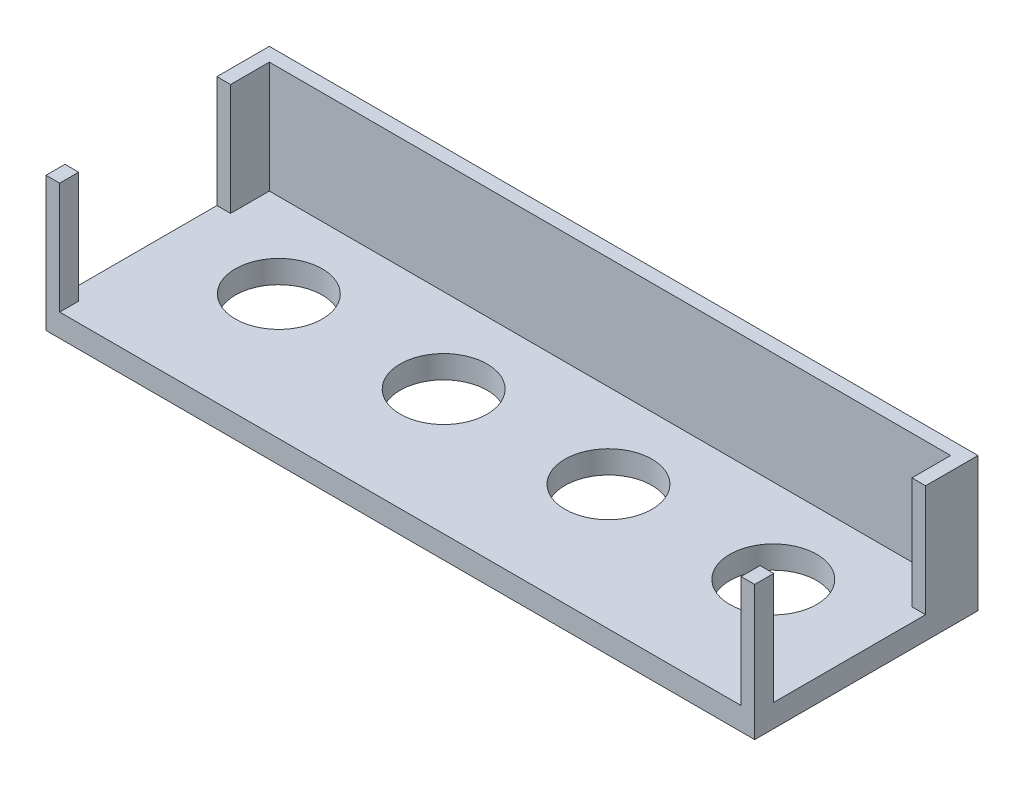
SolidWorks part; units mm, degrees
ref_plane "Alzado" through (0, 0, 0) normal (0, 0, 1) x (1, 0, 0)
ref_plane "Planta" through (0, 0, 0) normal (0, 1, 0) x (1, 0, 0)
ref_plane "Vista lateral" through (0, 0, 0) normal (1, 0, 0) x (0, 0, -1)
sketch "Croquis1" plane through (0, 0, 0) normal (0, 1, 0) x (1, 0, 0)
  line L1 (0, 0) -> (89.3, 0)
  line L2 (0, 0) -> (0, 54.8)
  line L3 (0, 54.8) -> (89.3, 54.8)
  line L4 (89.3, 0) -> (89.3, 54.8)
  circle A0 centre (12.15, 43.9) radius 5.725
  circle A1 centre (33.85, 43.9) radius 5.725
  circle A2 centre (55.55, 43.9) radius 5.725
  circle A3 centre (77.25, 43.9) radius 5.725
  dimension "D3" = 11.45
  dimension "D1" = 89.3
  dimension "D2" = 54.8
  dimension "D4" = 10.9
  dimension "D5" = 12.15
  dimension "D6" = 4
extrude "Saliente-Extruir1" add sketch "Croquis1" along normal blind 3
sketch "Croquis2" plane through (0, 0, 0) normal (0, 1, 0) x (1, 0, 0)
  line L0 (-2, 56.8) -> (-2, -2)
  line L1 (0, 54.8) -> (89.3, 54.8)
  line L2 (0, 54.8) -> (0, 0)
  line L3 (0, 0) -> (89.3, 0)
  line L4 (89.3, 54.8) -> (89.3, 0)
  line L5 (-2, -2) -> (91.3, -2)
  line L6 (91.3, 56.8) -> (91.3, -2)
  line L7 (-2, 56.8) -> (91.3, 56.8)
  dimension "D1" = 2
extrude "Saliente-Extruir2" add sketch "Croquis2" along normal blind 17.7
sketch "Croquis4" plane through (0, 0, 0) normal (1, 0, 0) x (0, 0, -1)
  line L1 (29.9, 3) -> (49.9, 3)
  line L2 (29.9, 3) -> (29.9, 8)
  line L3 (29.9, 8) -> (49.9, 8)
  line L4 (49.9, 3) -> (49.9, 8)
  line L5 (54.8, 17.7) -> (54.8, 3) construction
  line L6 (54.8, 3) -> (0, 3) construction
  dimension "D1" = 5
  dimension "D2" = 20
  dimension "D3" = 4.9
  dimension "D4" = 0
extrude "Cortar-Extruir3" cut sketch "Croquis4" along normal through all and the other way through all
sketch "Croquis5" plane through (0, 0, 0) normal (0, 1, 0) x (1, 0, 0)
  line L0 (-2, 27.4) -> (-11.6863, 27.4) construction
  line L2 (-2, 56.8) -> (-2, -2) construction
  line L4 (-2, 27.4) -> (91.3, 27.4)
  line L5 (-2, 27.4) -> (-2, -2)
  line L6 (-2, -2) -> (91.3, -2)
  line L7 (91.3, 27.4) -> (91.3, -2)
extrude "Cortar-Extruir4" cut sketch "Croquis5" along normal through all
ref_plane "Plano4" through (0, 0, -27.4) normal (0, 0, 1) x (1, 0, 0)
ref_plane "Plano5" through (0, 17.7, 0) normal (0, 1, 0) x (1, 0, 0)
sketch "Croquis7" plane through (0, 17.7, 0) normal (0, 1, 0) x (1, 0, 0)
  line L6 (-0.2, 55) -> (-0.2, 27.2)
  line L7 (89.5, 27.2) -> (-0.2, 27.2)
  line L8 (89.5, 55) -> (89.5, 27.2)
  line L9 (89.5, 55) -> (-0.2, 55)
extrude "Cortar-Extruir5" cut sketch "Croquis7" against normal up to surface (14.7 mm away)
sketch "Croquis8" plane through (0, 0, 0) normal (1, 0, 0) x (0, 0, -1)
  line L0 (49.9, 3) -> (49.9, 8) construction
  line L1 (29.9, 8) -> (49.9, 8)
  line L2 (29.9, 8) -> (29.9, 24.3467)
  line L3 (29.9, 24.3467) -> (49.9, 24.3467)
  line L4 (49.9, 8) -> (49.9, 24.3467)
  dimension "D1" = 0
extrude "Cortar-Extruir6" cut sketch "Croquis8" against normal through all both and the other way through all
